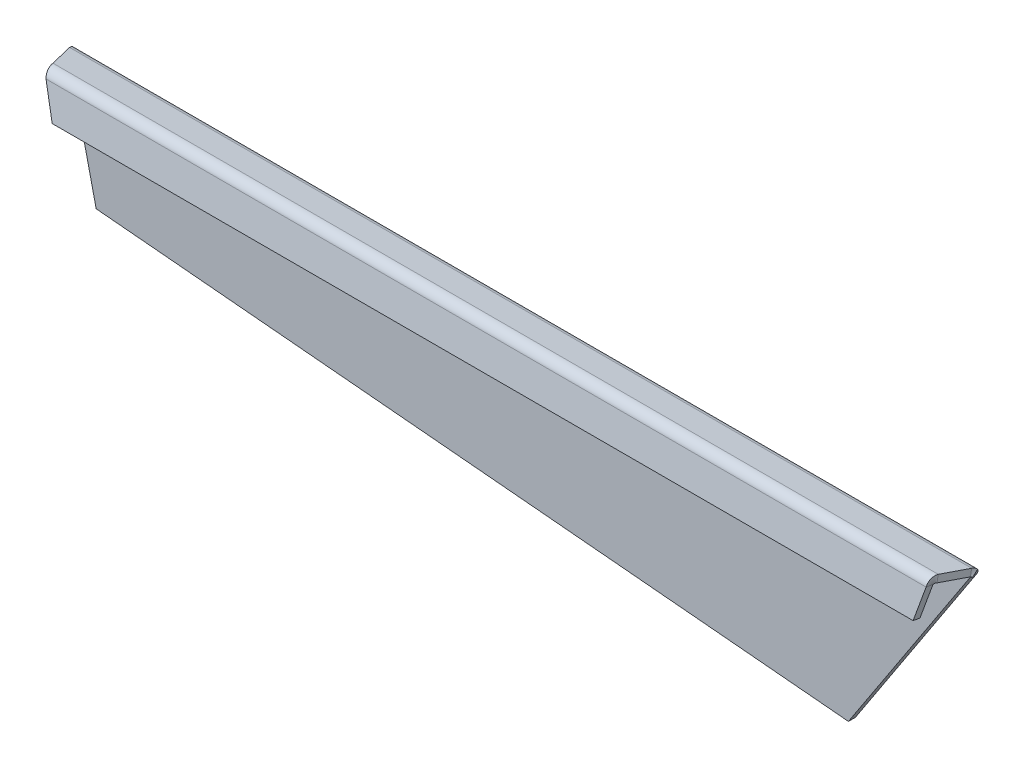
SolidWorks part; units mm, degrees
ref_plane "前视基准面" through (0, 0, 0) normal (0, 0, 1) x (1, 0, 0)
ref_plane "上视基准面" through (0, 0, 0) normal (0, 1, 0) x (1, 0, 0)
ref_plane "右视基准面" through (0, 0, 0) normal (1, 0, 0) x (0, 0, -1)
sketch "草图1" plane through (0, 0, 0) normal (0, 0, 1) x (1, 0, 0)
  line L0 (0, 0) -> (-1040, 0) construction
  line L1 (0, 0) -> (-20, 80)
  line L2 (0, 0) -> (-143, -218)
  line L3 (-20, 80) -> (-1010, 80)
  line L4 (-1010, 80) -> (-1040, 0)
  line L5 (-1008, -140) -> (-143, -218)
  line L6 (-1040, 0) -> (-1008, -140)
  dimension "D1" = 1040
  dimension "D2" = 218
  dimension "D3" = 143
  dimension "D4" = 298
  dimension "D5" = 20
  dimension "D6" = 990
  dimension "D7" = 32
  dimension "D8" = 140
sheet metal parameters "钣金1" thickness 8 parameters "D1"=2
base flange "基体-法兰1" sketch "草图1" thickness 8 reverse thickness direction yes parameters "D1"=2
sketch "草图3" plane through (0, 0, 8) normal (0, 0, 1) x (1, 0, 0)
  line L2 (-20, 0) -> (-1010, 0)
  line L3 (-20, 0) -> (-1010, 0)
  dimension "D1" = 80
sketched bend "绘制的折弯1" parameters "D1"=2
bend "草图折弯1" bend radius 2 bend angle 80 parameters "D5"=1
sketch "草图4" plane through (0, -3.803, 0.6706) normal (0, -0.9848, 0.1736) x (1, 0, 0)
  line L2 (-20, 44.9319) -> (-1010, 44.9319)
  line L3 (-20, 44.9319) -> (-1010, 44.9319)
  dimension "D1" = 40
sketched bend "绘制的折弯2" parameters "D1"=2
bend "草图折弯2" bend radius 2 bend angle 90 parameters "D5"=2
flat pattern "平板型式1"
sketch "折弯-线1" plane through (0, 0, 0) normal (0, 1, 0) x (-1, 0, 0)
bend of the flat pattern "展开-<草图折弯1>1"
bend of the flat pattern "展开-<草图折弯2>1"
